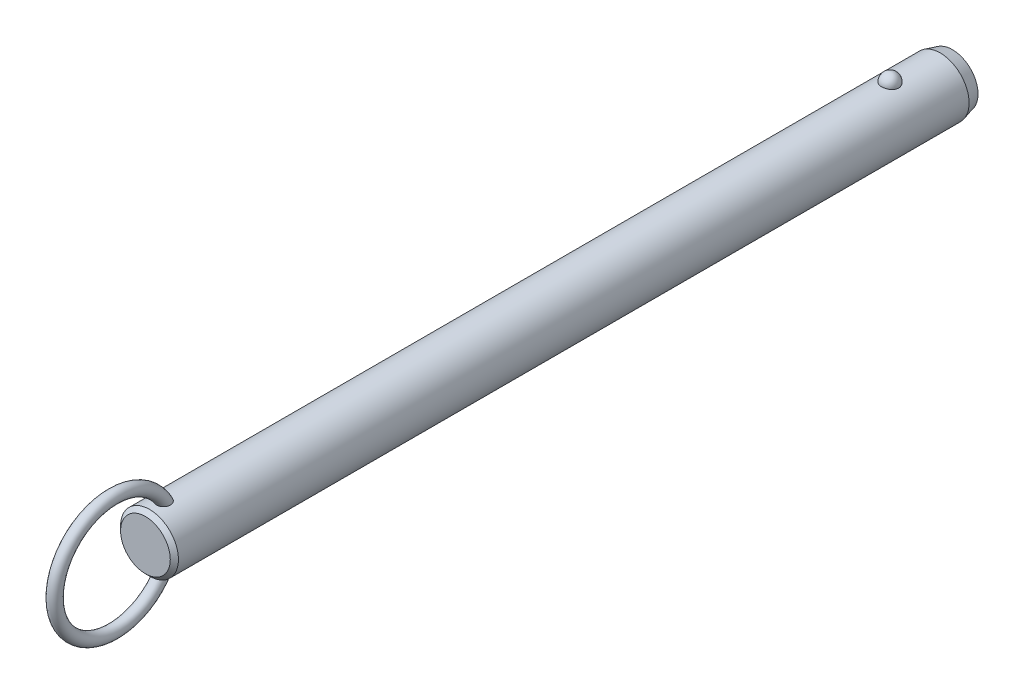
SolidWorks part; units mm, degrees
ref_plane "Front Plane" through (0, 0, 0) normal (0, 0, 1) x (1, 0, 0)
ref_plane "Top Plane" through (0, 0, 0) normal (0, 1, 0) x (1, 0, 0)
ref_plane "Right Plane" through (0, 0, 0) normal (1, 0, 0) x (0, 0, -1)
sketch "Sketch2" plane through (0, 0, 0) normal (0, 0, 1) x (1, 0, 0)
  circle A0 centre (0, 0) radius 7.1
  point P3 (0, 7.1)
  dimension "D1" = 14.2
extrude "Boss-Extrude1" add sketch "Sketch2" along normal blind 172.7
sketch "Sketch3" plane through (0, 0, 0) normal (0, 0, -1) x (-1, 0, 0)
  circle A0 centre (0, 0) radius 7.1
  dimension "D1" = 14.2
extrude "Boss-Extrude2" add sketch "Sketch3" along normal blind 17.4
chamfer "Chamfer1" distance 3 angle 15 1 edges at (-7.1, 0, -17.4)
sketch "Sketch12" plane through (0, 0, 0) normal (1, 0, 0) x (0, 0, -1)
  line L0 (-172.7, 7.1) -> (-172.7, -7.1) construction
  point P0 (-172.7, 0)
sketch "Sketch13" plane through (0, 0, 0) normal (1, 0, 0) x (0, 0, -1)
  circle A0 centre (-188.55, 0) radius 15.85
  point P2 (-172.7, 0)
  dimension "D1" = 31.7
sketch "Sketch14" plane through (0, 0, 0) normal (0, 1, 0) x (1, 0, 0)
  circle A0 centre (0, -174.2) radius 1.5
  point P2 (0, -172.7)
  dimension "D1" = 3
sweep "Sweep1" add profiles "Sketch14" path "Sketch13"
sketch "Sketch15" plane through (0, 0, 172.7) normal (0, 0, 1) x (1, 0, 0)
  circle A0 centre (0, 0) radius 7.1
  dimension "D1" = 14.2
extrude "Boss-Extrude3" add sketch "Sketch15" along normal blind 7.92
chamfer "Chamfer2" distance 1 angle 45 1 edges at (7.1, 0, 180.62)
sketch "Sketch18" plane through (0, 0, 0) normal (1, 0, 0) x (0, 0, -1)
  line L0 (14.4, 7.1) -> (-174.3792, 7.1) construction
  line L1 (2.1, 9.2) -> (2.1, 5)
  line L2 (-174.3792, -7.1) -> (14.4, -7.1) construction
  arc A0 (2.1, 9.2) -> (2.1, 5) centre (2.1, 7.1) ccw
  point P4 (0, 7.1)
  dimension "D1" = 16.3
revolve "Revolve1" add sketch "Sketch18" angle 360 about L1
